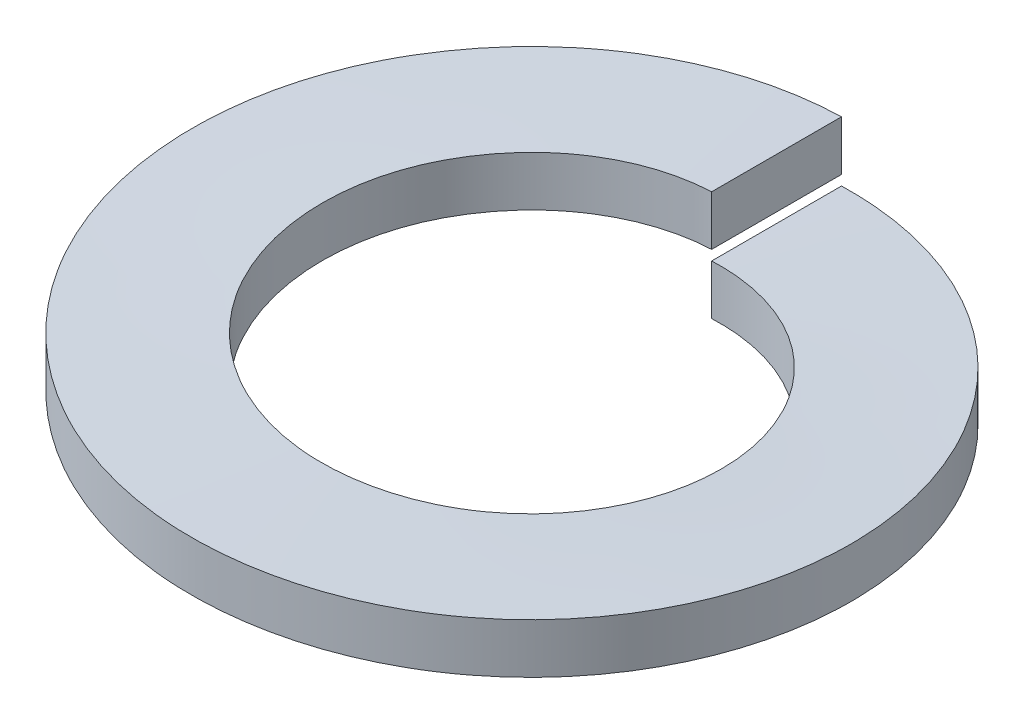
SolidWorks part; units mm, degrees
ref_plane "Plan de face" through (0, 0, 0) normal (0, 0, 1) x (1, 0, 0)
ref_plane "Plan de dessus" through (0, 0, 0) normal (0, 1, 0) x (1, 0, 0)
ref_plane "Plan de droite" through (0, 0, 0) normal (1, 0, 0) x (0, 0, -1)
sketch "Esquisse1" plane through (0, 0, 0) normal (0, 1, 0) x (1, 0, 0)
  circle A0 centre (0, 0) radius 2.5
  dimension "D1" = 5
curve "Hélice/Spirale1"
sketch "Esquisse2" plane through (0, 0, 0) normal (1, 0, 0) x (0, 0, -1)
  line L1 (2, 0.85) -> (3.3, 0.85)
  line L2 (2, 0.85) -> (2, 0.35)
  line L3 (2, 0.35) -> (3.3, 0.35)
  line L4 (3.3, 0.85) -> (3.3, 0.35)
  spline S0 degree 3 poles (2.5, 0) (2.5, 0.0124) (2.3698, 0.0375) (1.8138, 0.075) (0.9816, 0.1125) (0, 0.15) (-0.9816, 0.1875) (-1.8138, 0.225) (-2.3698, 0.2625) (-2.5651, 0.3) (-2.3698, 0.3375) (-1.8138, 0.375) (-0.9816, 0.4125) (0, 0.45) (0.9816, 0.4875) (1.8138, 0.525) (2.3698, 0.5625) (2.5, 0.5876) (2.5, 0.6) knots 0 0 0 0 0.0625 0.125 0.1875 0.25 0.3125 0.375 0.4375 0.5 0.5625 0.625 0.6875 0.75 0.8125 0.875 0.9375 1 1 1 1 construction
  point P6 (2.5, 0.6)
  dimension "D1" = 1.3
  dimension "D2" = 0.5
  dimension "D3" = 0.8
  dimension "D4" = 0.25
  dimension "D5" = 2
sweep "Balayage1" add profiles "Esquisse2" path "Hélice/Spirale1"
